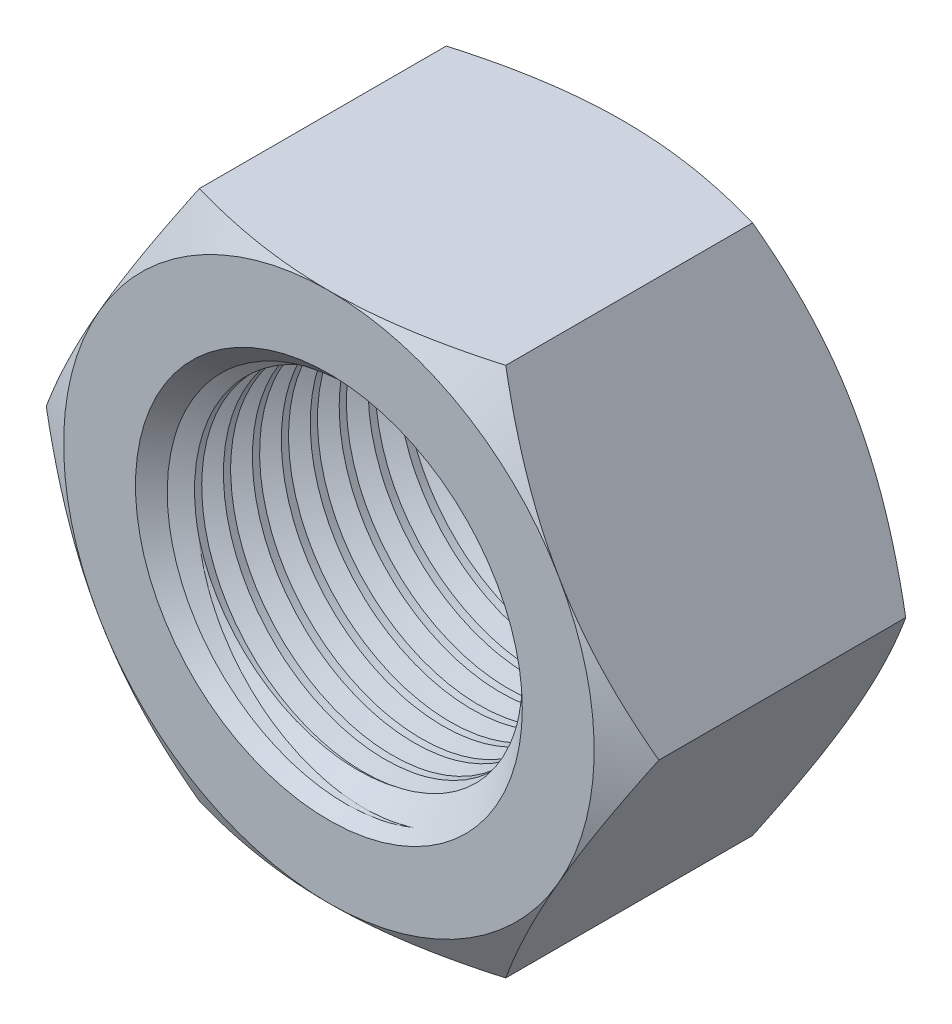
SolidWorks part; units mm, degrees
ref_plane "Front" through (0, 0, 0) normal (0, 0, 1) x (1, 0, 0)
ref_plane "Top" through (0, 0, 0) normal (0, 1, 0) x (1, 0, 0)
ref_plane "Right" through (0, 0, 0) normal (1, 0, 0) x (0, 0, -1)
sketch "Çizim1" plane through (0, 0, 0) normal (0, 0, 1) x (1, 0, 0)
  line L1 (63.5085, 0) -> (31.7543, 55)
  line L2 (31.7543, 55) -> (-31.7543, 55)
  line L3 (-31.7543, 55) -> (-63.5085, 0)
  line L4 (-63.5085, 0) -> (-31.7543, -55)
  line L5 (-31.7543, -55) -> (31.7543, -55)
  line L6 (31.7543, -55) -> (63.5085, 0)
  circle A0 centre (0, 0) radius 55 construction
  point P1 (0, 0)
  dimension "D1" = 110
extrude "Yükseklik-Ekstrüzyon1" add sketch "Çizim1" along normal blind 61
sketch "Çizim2" plane through (0, 0, 61) normal (0, 0, 1) x (1, 0, 0)
  circle A0 centre (0, 0) radius 55
extrude "Kes-Ekstrüzyon1" cut sketch "Çizim2" against normal blind 61 draft 60 flip side to cut
sketch "Çizim3" plane through (0, 0, 0) normal (0, 0, -1) x (-1, 0, 0)
  circle A0 centre (0, 0) radius 55
extrude "Kes-Ekstrüzyon2" cut sketch "Çizim3" against normal blind 61 draft 60 flip side to cut
sketch "Çizim4" plane through (0, 0, 61) normal (0, 0, 1) x (1, 0, 0)
  circle A0 centre (0, 0) radius 34.1
  dimension "D1" = 68.2
extrude "Kes-Ekstrüzyon3" cut sketch "Çizim4" against normal blind 61
chamfer "Pah1" distance 6 angle 45 2 edges at (34.1, 0, 0) (34.1, 0, 61)
sketch "Çizim5" plane through (0, 0, 0) normal (0, 0, -1) x (-1, 0, 0)
  circle A0 centre (0, 0) radius 34.1
curve "Helis/Spiral1"
ref_plane "Düzlem1" through (-17.05, -29.5315, 70) normal (0.8657, -0.4998, 0.028) x (0.0242, -0.014, -0.9996)
sketch "Çizim6" plane through (-17.05, -29.5315, 70) normal (0.8657, -0.4998, 0.028) x (0.0242, -0.014, -0.9996)
  line L0 (-2.9792, 1.2601) -> (2.9792, 1.2601)
  line L1 (0, -3.9) -> (2.9792, 1.2601)
  line L3 (-2.9792, 1.2601) -> (0, -3.9)
  line L5 (0, 1.95) -> (-3.3775, 1.95)
  circle A0 centre (0, 0) radius 1.95 construction
  dimension "D1" = 3.9
sweep "Kes-Süpür1" cut profiles "Çizim6" path "Helis/Spiral1"
